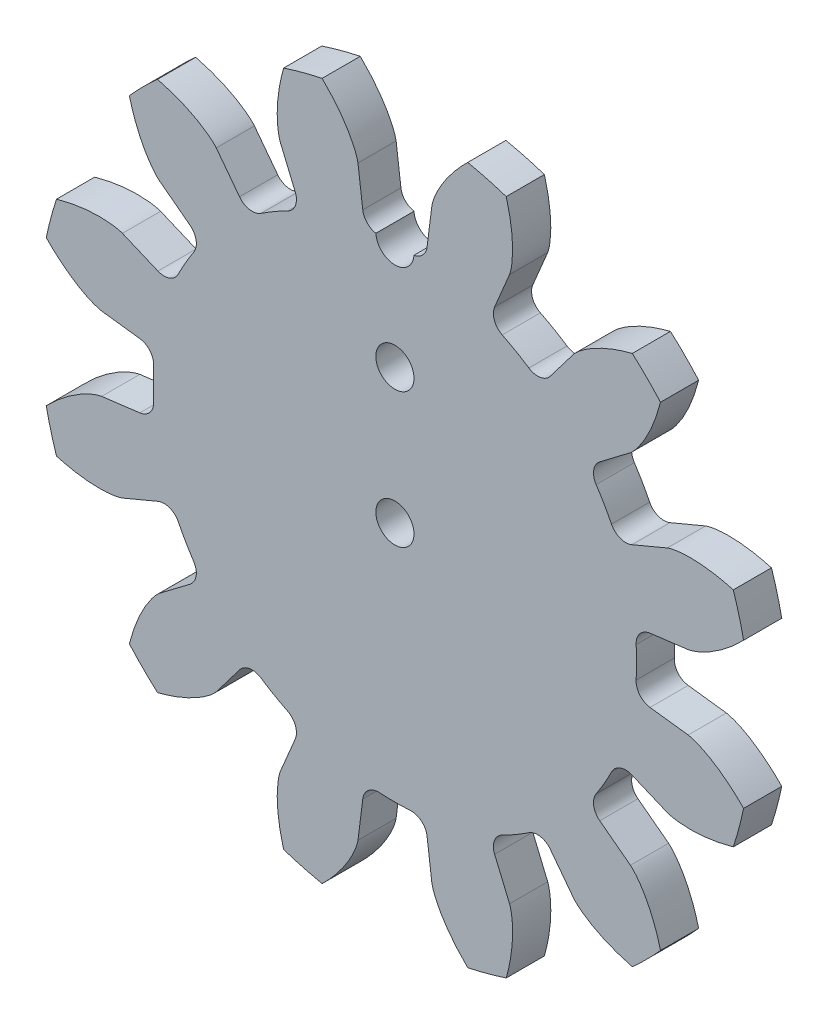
SolidWorks part; units mm, degrees
ref_plane "Front Plane" through (0, 0, 0) normal (0, 0, 1) x (1, 0, 0)
ref_plane "Top Plane" through (0, 0, 0) normal (0, 1, 0) x (1, 0, 0)
ref_plane "Right Plane" through (0, 0, 0) normal (1, 0, 0) x (0, 0, -1)
sketch "BaseCylinderSketch" plane through (0, 0, 0) normal (0, 0, 1) x (1, 0, 0)
  circle A0 centre (0, 0) radius 29.6333
  circle A1 centre (0, 0) radius 1.5875
extrude "BaseCylinder" add sketch "BaseCylinderSketch" along normal blind 3.175
sketch "InvoluteCurvesAndToothGulletSketch" plane through (0, 0, 3.175) normal (0, 0, 1) x (1, 0, 0)
  line L0 (19.9506, 2.5141) -> (0, 0) construction
  line L1 (0, 0) -> (19.9506, -2.5141) construction
  line L2 (19.9506, -2.5141) -> (24.398, -3.0745)
  line L3 (19.9506, 2.5141) -> (24.398, 3.0745)
  circle A0 centre (0, 0) radius 20.1083 construction
  circle A1 centre (0, 0) radius 24.591 construction
  circle A2 centre (0, 0) radius 25.4 construction
  circle A3 centre (0, 0) radius 29.6333 construction
  arc A4 (19.9506, 2.5141) -> (19.9506, -2.5141) centre (0, 0) cw
  spline S0 degree 4 poles (24.398, 3.0745) (24.4061, 3.0757) (24.4289, 3.0792) (24.4718, 3.0874) (24.5414, 3.1027) (24.6295, 3.1252) (24.7428, 3.1575) (24.8752, 3.2) (25.0197, 3.2511) (25.1756, 3.3115) (25.33, 3.376) (25.4828, 3.4443) (25.634, 3.5159) (25.8159, 3.6067) (26.032, 3.7213) (26.2816, 3.8636) (26.5612, 4.0347) (26.842, 4.2194) (27.1149, 4.4095) (27.3864, 4.6112) (27.6462, 4.8131) (27.9115, 5.0324) (28.1541, 5.2397) (28.4207, 5.4824) (28.6343, 5.6814) (28.9102, 5.9549) (29.0714, 6.1197) (29.258, 6.3163) (29.3398, 6.4056) (29.3902, 6.4605) knots 0 0 0 0 0 0.005377 0.015084 0.028532 0.04661 0.064855 0.092111 0.119476 0.146842 0.174209 0.201575 0.228941 0.256307 0.307035 0.361767 0.4165 0.471232 0.525964 0.580697 0.635429 0.690161 0.744894 0.799626 0.854358 0.909091 0.954545 1 1 1 1 1 construction
  spline S1 degree 4 poles (24.398, 3.0745) (24.4061, 3.0757) (24.4289, 3.0792) (24.4718, 3.0874) (24.5414, 3.1027) (24.6295, 3.1252) (24.7428, 3.1575) (24.8752, 3.2) (25.0197, 3.2511) (25.1756, 3.3115) (25.33, 3.376) (25.4828, 3.4443) (25.634, 3.5159) (25.8159, 3.6067) (26.032, 3.7213) (26.2816, 3.8636) (26.5612, 4.0347) (26.842, 4.2194) (27.1149, 4.4095) (27.3864, 4.6112) (27.6462, 4.8131) (27.9115, 5.0324) (28.1541, 5.2397) (28.4207, 5.4824) (28.6343, 5.6814) (28.8504, 5.8956) (28.9549, 6.0011) (29.008, 6.0556) knots 0 0 0 0 0 0.005377 0.015084 0.028532 0.04661 0.064855 0.092111 0.119476 0.146842 0.174209 0.201575 0.228941 0.256307 0.307035 0.361767 0.4165 0.471232 0.525964 0.580697 0.635429 0.690161 0.744894 0.799626 0.854358 0.909091 0.909091 0.909091 0.909091 0.909091
  spline S2 degree 4 poles (24.398, -3.0745) (24.4061, -3.0757) (24.4289, -3.0792) (24.4718, -3.0874) (24.5414, -3.1027) (24.6295, -3.1252) (24.7428, -3.1575) (24.8752, -3.2) (25.0197, -3.2511) (25.1756, -3.3115) (25.33, -3.376) (25.4828, -3.4443) (25.634, -3.5159) (25.8159, -3.6067) (26.032, -3.7213) (26.2816, -3.8636) (26.5612, -4.0347) (26.842, -4.2194) (27.1149, -4.4095) (27.3864, -4.6112) (27.6462, -4.8131) (27.9115, -5.0324) (28.1541, -5.2397) (28.4207, -5.4824) (28.6343, -5.6814) (28.9102, -5.9549) (29.0714, -6.1197) (29.258, -6.3163) (29.3398, -6.4056) (29.3902, -6.4605) knots 0 0 0 0 0 0.005377 0.015084 0.028532 0.04661 0.064855 0.092111 0.119476 0.146842 0.174209 0.201575 0.228941 0.256307 0.307035 0.361767 0.4165 0.471232 0.525964 0.580697 0.635429 0.690161 0.744894 0.799626 0.854358 0.909091 0.954545 1 1 1 1 1 construction
  spline S3 degree 4 poles (24.398, -3.0745) (24.4061, -3.0757) (24.4289, -3.0792) (24.4718, -3.0874) (24.5414, -3.1027) (24.6295, -3.1252) (24.7428, -3.1575) (24.8752, -3.2) (25.0197, -3.2511) (25.1756, -3.3115) (25.33, -3.376) (25.4828, -3.4443) (25.634, -3.5159) (25.8159, -3.6067) (26.032, -3.7213) (26.2816, -3.8636) (26.5612, -4.0347) (26.842, -4.2194) (27.1149, -4.4095) (27.3864, -4.6112) (27.6462, -4.8131) (27.9115, -5.0324) (28.1541, -5.2397) (28.4207, -5.4824) (28.6343, -5.6814) (28.8504, -5.8956) (28.9549, -6.0011) (29.008, -6.0556) knots 0 0 0 0 0 0.005377 0.015084 0.028532 0.04661 0.064855 0.092111 0.119476 0.146842 0.174209 0.201575 0.228941 0.256307 0.307035 0.361767 0.4165 0.471232 0.525964 0.580697 0.635429 0.690161 0.744894 0.799626 0.854358 0.909091 0.909091 0.909091 0.909091 0.909091
extrude "Tooth" cut sketch "InvoluteCurvesAndToothGulletSketch" against normal through all and the other way through all
sketch "InnerRadius" plane through (0, 0, 0) normal (0, 0, 1) x (1, 0, 0)
  circle A0 centre (0, 0) radius 20.1083 construction
  circle A1 centre (0, 0) radius 20.1083 construction
fillet "ToothGulletFillet" radius 1.3233 2 edges at (19.9506, 2.5141, 1.5875) (19.9506, -2.5141, 1.5875)
pattern_circular "Teeth" count 12 over 360 about axis through (0, 0, 3.175) along (0, 0, -1) of "ToothGulletFillet", "Tooth"
hole_wizard "1/8 (0.1250) Dowel Hole1" positions "Sketch1" profile "Sketch2" hole size "1/8" standard "ANSI Inch"
sketch "Sketch1" plane through (0, 0, 0) normal (0, 0, -1) x (-1, 0, 0)
  point P0 (0, 11.2215)
  point P2 (0, 20.1795)
  point P4 (0, 31.8115)
sketch "Sketch2" plane through (0, 11.2215, 0) normal (1, 0, 0) x (0, 1, 0)
  line L0 (0, 0) -> (0, 3.175)
  line L1 (0, 3.175) -> (1.5875, 3.175)
  line L2 (1.5875, 3.175) -> (1.5875, 0)
  line L5 (1.5875, 0) -> (0, 0)
  line L11 (0, -6.35) -> (0, 107.95) construction
  dimension "Thru Hole Dia." = 3.175
  dimension "Thru Hole Depth" = 3.175
equation "\"DiametralPitch\"= 6'\"Pitch Diameter\""
equation "\"NumTeeth\"= 12'\"Number of Teeth\""
equation "\"PressureAngle\"= 14.5deg"
equation "\"Addendum\"= 1 / \"DiametralPitch\""
equation "\"Dedendum\"= 1.25 / \"DiametralPitch\""
equation "\"WorkingDepth\"= 2 / \"DiametralPitch\""
equation "\"WholeDepth\"= 2.25 / \"DiametralPitch\""
equation "\"Clearance\"= 0.25 / \"DiametralPitch\""
equation "\"ToothThickness\"= 1.5708 / \"DiametralPitch\""
equation "\"CircularPitch\"= pi / \"DiametralPitch\""
equation "\"PitchCircle\"= \"NumTeeth\" / \"DiametralPitch\""
equation "\"OutsideDiameter\"= ( \"NumTeeth\" + 2 ) / \"DiametralPitch\""
equation "\"Fillet\"= \"Clearance\" * cos ( \"PressureAngle\" ) * tan ( ( 90 + \"PressureAngle\" ) / 2 )"
equation "\"AddendumCircle\"= \"PitchCircle\" + ( 2 * \"Addendum\" )"
equation "\"DedendumCircle\"= \"PitchCircle\" - ( 2 * \"Dedendum\" )"
equation "\"BaseCircle\"= \"PitchCircle\" * cos ( \"PressureAngle\" )"
equation "\"PitchAngle\"= 360deg / \"NumTeeth\""
equation "\"Alpha\"= sqr ( \"PitchCircle\" ^ 2 - \"BaseCircle\" ^ 2 ) / \"BaseCircle\" * 180 / PI - \"PressureAngle\""
equation "\"Beta\"= ( \"PitchAngle\" / 4 - \"Alpha\" )"
equation "\"Phi\"= sqr ( ( \"AddendumCircle\" / 2 ) ^ 2 - ( \"BaseCircle\" / 2 ) ^ 2 ) / ( \"BaseCircle\" / 2 )"
equation "\"D1@BaseCylinderSketch\" = \"OutsideDiameter\""
equation "\"D1@InvoluteCurvesAndToothGulletSketch\" = \"OutsideDiameter\""
equation "\"D2@InvoluteCurvesAndToothGulletSketch\" = \"PitchCircle\""
equation "\"D3@InvoluteCurvesAndToothGulletSketch\" = \"BaseCircle\""
equation "\"D4@InvoluteCurvesAndToothGulletSketch\" = \"DedendumCircle\""
equation "\"D1@ToothGulletFillet\" = \"Fillet\""
equation "\"D1@Teeth\" = \"NumTeeth\""
equation "\"MaterialThickness\"= .125in'\"Gear Thickness\""
equation "\"BoreDiameter\"= .125in'\"Bore Diameter\""
equation "\"D2@BaseCylinderSketch\" = \"BoreDiameter\""
equation "\"D1@BaseCylinder\"=\"MaterialThickness\""
